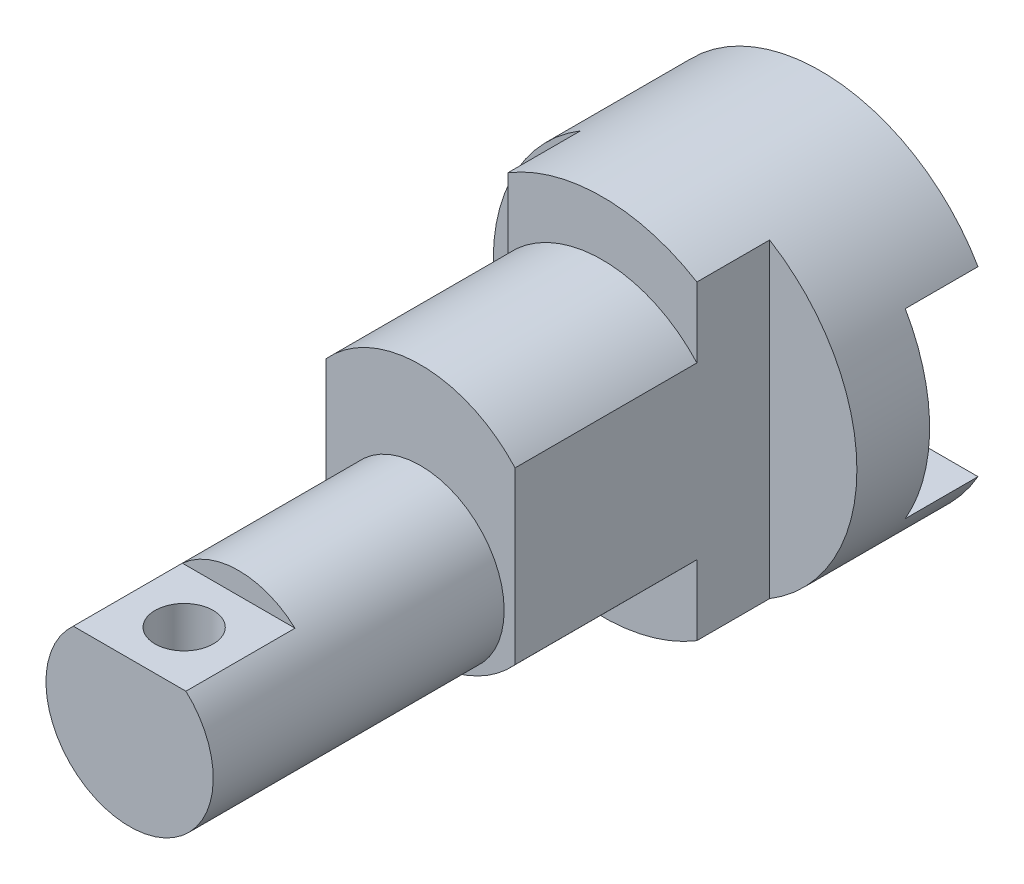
SolidWorks part; units mm, degrees
ref_plane "前视基准面" through (0, 0, 0) normal (0, 0, 1) x (1, 0, 0)
ref_plane "上视基准面" through (0, 0, 0) normal (0, 1, 0) x (1, 0, 0)
ref_plane "右视基准面" through (0, 0, 0) normal (1, 0, 0) x (0, 0, -1)
sketch "草图1" plane through (0, 0, 0) normal (0, 0, 1) x (1, 0, 0)
  circle A0 centre (0, 0) radius 50
  dimension "D1" = 100
extrude "拉伸1" add sketch "草图1" along normal blind 60
sketch "草图2" plane through (0, 0, 60) normal (0, 0, 1) x (1, 0, 0)
  circle A0 centre (0, 0) radius 35
  dimension "D1" = 70
extrude "拉伸2" add sketch "草图2" along normal blind 50
sketch "草图3" plane through (0, 0, 110) normal (0, 0, 1) x (1, 0, 0)
  circle A0 centre (0, -12) radius 23
  circle A1 centre (0, 0) radius 35 construction
  dimension "D1" = 46
extrude "拉伸3" add sketch "草图3" along normal blind 80
ref_plane "基准面1" through (0, 20, 0) normal (0, 1, 0) x (-1, 0, 0)
sketch "草图4" plane through (0, 20, 0) normal (0, 1, 0) x (1, 0, 0)
  line L0 (0, 0) -> (0, -199.8062) construction
  line L1 (-20, -190) -> (-20, -160)
  line L2 (-23, -190) -> (23, -190) construction
  line L3 (-20, -160) -> (20, -160)
  line L4 (20, -160) -> (20, -190)
  line L5 (20, -190) -> (-20, -190)
  dimension "D1" = 40
  dimension "D2" = 30
extrude "切除-拉伸1" cut sketch "草图4" against normal blind 15
sketch "草图5" plane through (0, 5, 0) normal (0, 1, 0) x (1, 0, 0)
  line L0 (0, -190) -> (0, -135.3206) construction
  line L1 (-15.4919, -190) -> (15.4919, -190) construction
  line L2 (15.4919, -175) -> (-15.4919, -175) construction
  line L3 (15.4919, -160) -> (15.4919, -190) construction
  line L4 (-15.4919, -190) -> (-15.4919, -160) construction
  circle A0 centre (0, -175) radius 8
  dimension "D1" = 16
extrude "切除-拉伸2" cut sketch "草图5" against normal through all
ref_plane "基准面2" through (0, 0, 40) normal (0, 0, 1) x (1, 0, 0)
sketch "草图6" plane through (0, 0, 40) normal (0, 0, 1) x (1, 0, 0)
  line L0 (0, -64.3133) -> (0, 63.6316) construction
  line L1 (26, -42.7083) -> (26, 42.7083)
  line L2 (-26, 42.7083) -> (-26, -42.7083)
  arc A0 (-26, 42.7083) -> (-26, -42.7083) centre (0, 0) ccw
  arc A1 (26, -42.7083) -> (26, 42.7083) centre (0, 0) ccw
  dimension "D1" = 100
  dimension "D2" = 52
extrude "切除-拉伸3" cut sketch "草图6" along normal through all
sketch "草图7" plane through (0, 0, 0) normal (1, 0, 0) x (0, 0, -1)
  line L0 (0, 25) -> (-20, 25)
  line L1 (0, -50) -> (0, 50) construction
  line L2 (-20, 25) -> (-20, -25)
  line L3 (-20, -25) -> (0, -25)
  line L4 (0, -25) -> (0, 25)
  line L5 (0, 0) -> (-53.4451, 0) construction
  dimension "D1" = 50
  dimension "D2" = 20
extrude "切除-拉伸4" cut sketch "草图7" against normal mid plane 120
